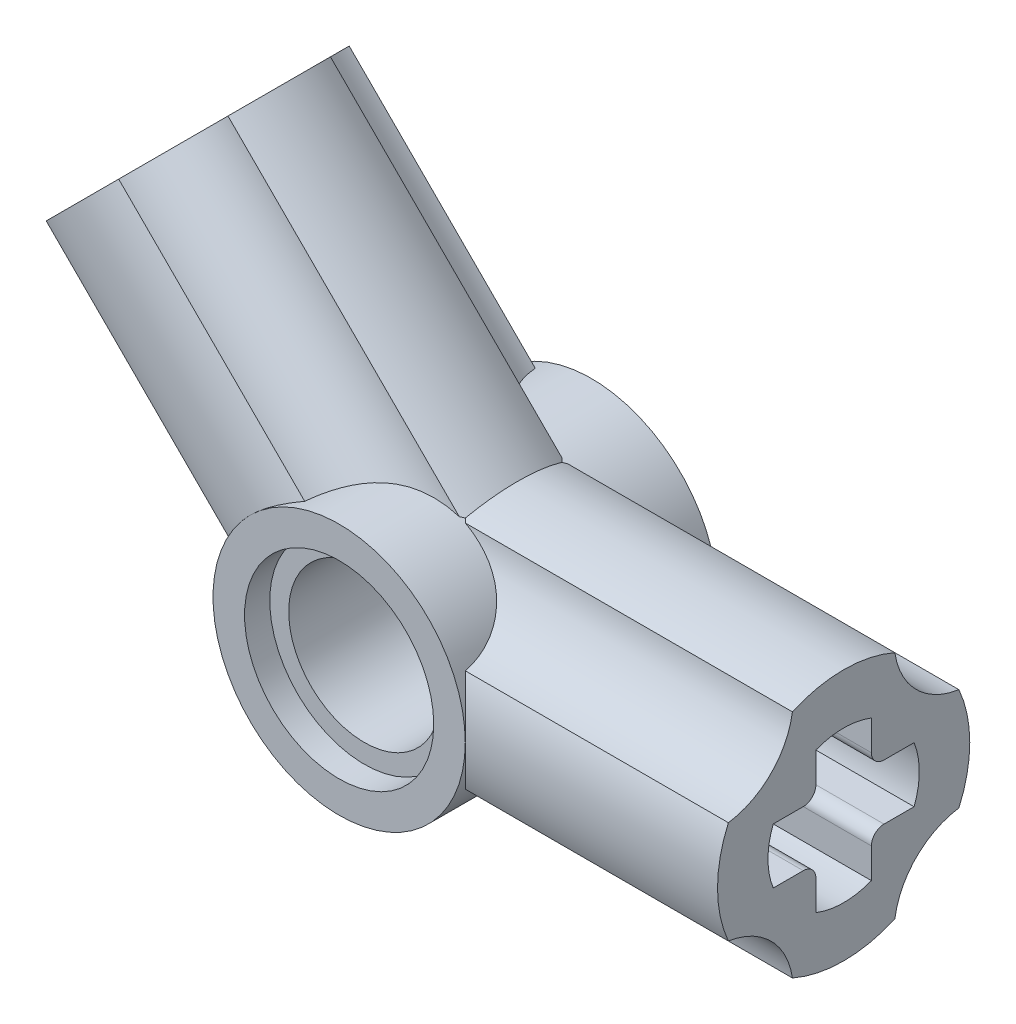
SolidWorks part; units mm, degrees
ref_plane "정면" through (0, 0, 0) normal (0, 0, 1) x (1, 0, 0)
ref_plane "윗면" through (0, 0, 0) normal (0, 1, 0) x (1, 0, 0)
ref_plane "우측면" through (0, 0, 0) normal (1, 0, 0) x (0, 0, -1)
sketch "스케치1" plane through (0, 0, 0) normal (0, 1, 0) x (1, 0, 0)
  line L0 (-8, 4) -> (-12, 4)
  line L1 (-12, 4) -> (-12, -4)
  line L2 (-12, -4) -> (-8, -4)
  line L3 (-8, -4) -> (-8, 4)
  line L4 (-12, 4) -> (-12, -4) construction
revolve "회전1" add sketch "스케치1" angle 360 about L4
sketch "스케치2" plane through (0, 0, 0) normal (1, 0, 0) x (0, 0, -1)
  arc A0 (-1.6249, -3.6551) -> (1.6249, -3.6551) centre (0, 0) ccw
  arc A1 (1.6249, -3.6551) -> (3.6551, -1.6249) centre (4, -4) cw
  arc A2 (3.6551, -1.6249) -> (3.6551, 1.6249) centre (0, 0) ccw
  arc A3 (3.6551, 1.6249) -> (1.6249, 3.6551) centre (4, 4) cw
  arc A4 (1.6249, 3.6551) -> (-1.6249, 3.6551) centre (0, 0) ccw
  arc A5 (-1.6249, 3.6551) -> (-3.6551, 1.6249) centre (-4, 4) cw
  arc A6 (-3.6551, 1.6249) -> (-3.6551, -1.6249) centre (0, 0) ccw
  arc A7 (-3.6551, -1.6249) -> (-1.6249, -3.6551) centre (-4, -4) cw
extrude "보스-돌출1" add sketch "스케치2" against normal up to next
imported_body "곡면-불러온 피처1"
sketch "스케치3" plane through (0, 0, 0) normal (1, 0, 0) x (0, 0, -1)
  line L0 (-0.88, 2.2328) -> (-0.88, 0.88)
  line L1 (-0.88, 0.88) -> (-2.2328, 0.88)
  line L2 (-2.2328, -0.88) -> (-0.88, -0.88)
  line L3 (-0.88, -0.88) -> (-0.88, -2.2328)
  line L4 (0.88, -2.2328) -> (0.88, -0.88)
  line L5 (0.88, -0.88) -> (2.2328, -0.88)
  line L6 (2.2328, 0.88) -> (0.88, 0.88)
  line L7 (0.88, 0.88) -> (0.88, 2.2328)
  arc A0 (-2.2328, 0.88) -> (-2.2328, -0.88) centre (0, 0) ccw
  arc A1 (-0.88, -2.2328) -> (0.88, -2.2328) centre (0, 0) ccw
  arc A2 (2.2328, -0.88) -> (2.2328, 0.88) centre (0, 0) ccw
  arc A3 (0.88, 2.2328) -> (-0.88, 2.2328) centre (0, 0) ccw
extrude "컷-돌출1" cut sketch "스케치3" against normal up to surface
sketch "스케치4" plane through (0, 0, 0) normal (0, 1, 0) x (1, 0, 0)
  line L0 (-9, 4) -> (-12, 4)
  line L1 (-12, 4) -> (-12, -4)
  line L2 (-12, -4) -> (-9, -4)
  line L3 (-9, -4) -> (-9, -3.2)
  line L4 (-9, -3.2) -> (-9.6, -3.2)
  line L5 (-9.6, -3.2) -> (-9.6, 3.2)
  line L6 (-9.6, 3.2) -> (-9, 3.2)
  line L7 (-9, 3.2) -> (-9, 4)
  line L8 (-12, 4) -> (-12, -4) construction
revolve "컷-회전1" cut sketch "스케치4" angle 360 about L8
fillet "필렛1" radius 0.4 4 edges at (-4.049, 0.88, 0.88) (-4.049, 0.88, -0.88) (-4.049, -0.88, -0.88) (-4.049, -0.88, 0.88)
pattern_circular "원형 패턴1" count 2 every 135 about axis through (-12, 0, 0) along (0, 0, 1) of "보스-돌출1", "컷-돌출1"
